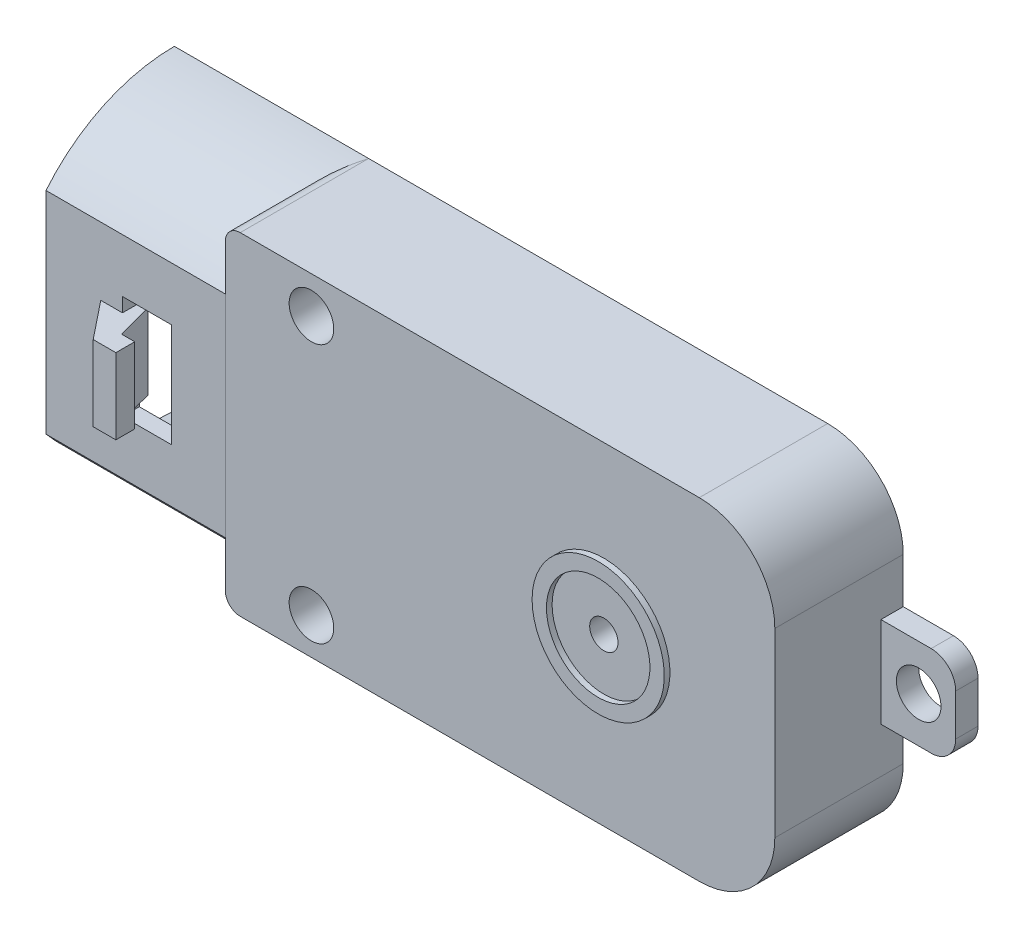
SolidWorks part; units mm, degrees
ref_plane "Front" through (0, 0, 0) normal (0, 0, 1) x (1, 0, 0)
ref_plane "Top" through (0, 0, 0) normal (0, 1, 0) x (1, 0, 0)
ref_plane "Right" through (0, 0, 0) normal (1, 0, 0) x (0, 0, -1)
sketch "Sketch1" plane through (0, 0, 0) normal (0, 0, 1) x (1, 0, 0)
  line L0 (11.5, 0) -> (-49.9329, 0) construction
  line L1 (11.5, 11.176) -> (-37.522, 11.176)
  line L2 (11.5, 11.176) -> (11.5, -11.176)
  line L3 (11.5, -11.176) -> (-37.522, -11.176)
  line L4 (-37.522, 11.176) -> (-37.522, -11.176)
  dimension "D1" = 49.022
  dimension "D2" = 22.352
  dimension "D3" = 11.5
extrude "Extrude1" add sketch "Sketch1" along normal blind 8.636
sketch "Sketch2" plane through (0, 0, 8.636) normal (0, 0, 1) x (1, 0, 0)
  line L0 (11.5, -11.176) -> (11.5, 11.176) construction
  line L1 (11.5, 11.176) -> (-37.522, 11.176) construction
  circle A0 centre (0, 0) radius 0.9525
  circle A3 centre (-19.6658, 8.7122) radius 1.5
  dimension "D1" = 1.905
  dimension "D2" = 2.4638
  dimension "D6" = 3
  dimension "D7" = 31.1658
extrude "Cut-Extrude1" cut sketch "Sketch2" against normal through all
ref_plane "Plane1" through (0, 0, 0) normal (0, 1, 0) x (-1, 0, 0)
mirror "Mirror1" about plane through (0, 0, 0) normal (0, 1, 0) of "Cut-Extrude1"
fillet "Fillet1" radius 5.08 2 edges at (11.5, -11.176, 4.318) (11.5, 11.176, 4.318)
sketch "Sketch3" plane through (0, 0, 8.636) normal (0, 0, 1) x (1, 0, 0)
  circle A0 centre (0, 0) radius 4.445
  circle A1 centre (0, 0) radius 3.4798
  dimension "D1" = 0.9652
  dimension "D2" = 8.89
extrude "Extrude2" add sketch "Sketch3" along normal blind 0.381
sketch "Sketch4" plane through (-37.522, 0, 0) normal (-1, 0, 0) x (0, 0, 1)
  line L0 (8.636, 11.176) -> (0, 11.176) construction
  line L3 (8.636, 11.176) -> (8.636, -11.176) construction
  line L5 (8.6335, 7.0969) -> (8.6335, 0)
  arc A0 (8.6335, 7.0969) -> (0, 11.176) centre (0, 0) ccw
  dimension "D1" = 0.0025
extrude "Cut-Extrude-Thin1" cut sketch "Sketch4" against normal blind 12.065 thin
mirror "Mirror5" about plane through (0, 0, 0) normal (0, 1, 0) of "Cut-Extrude-Thin1"
fillet "Fillet2" radius 1 2 edges at (-25.457, 11.176, 4.318) (-25.457, -11.176, 4.318)
sketch "Sketch8" plane through (0, 0, 8.6335) normal (0, 0, 1) x (1, 0, 0)
  line L0 (-37.522, -7.0969) -> (-37.522, 7.0969) construction
  line L1 (-29.0765, 3.4925) -> (-32.3785, 3.4925)
  line L2 (-29.0765, 3.4925) -> (-29.0765, -3.4925)
  line L3 (-29.0765, -3.4925) -> (-32.3785, -3.4925)
  line L4 (-32.3785, 3.4925) -> (-32.3785, -3.4925)
  line L5 (-37.522, -11.176) -> (-24.457, -11.176) construction
  dimension "D1" = 6.985
  dimension "D2" = 3.302
  dimension "D3" = 5.1435
  dimension "D4" = 7.6835
extrude "Cut-Extrude8" cut sketch "Sketch8" against normal blind 10
sketch "Sketch7" plane through (-37.522, 0, 0) normal (-1, 0, 0) x (0, 0, 1)
  line L0 (8.6335, -7.0969) -> (8.6335, 7.0969) construction
  line L1 (0, 11.176) -> (0, -11.176) construction
  line L2 (8.6335, -7.0969) -> (8.6335, 7.0969) construction
  line L3 (0, 11.176) -> (0, -11.176) construction
  line L4 (7.5035, -6.6798) -> (7.5035, 6.6798)
  line L5 (0, 10.046) -> (0, -10.046)
  arc A0 (0, -11.176) -> (8.6335, -7.0969) centre (0, 0) ccw construction
  arc A1 (8.6335, 7.0969) -> (0, 11.176) centre (0, 0) ccw construction
  arc A2 (0, -11.176) -> (8.6335, -7.0969) centre (0, 0) ccw construction
  arc A3 (8.6335, 7.0969) -> (0, 11.176) centre (0, 0) ccw construction
  arc A4 (7.5035, 6.6798) -> (0, 10.046) centre (0, 0) ccw
  arc A5 (0, -10.046) -> (7.5035, -6.6798) centre (0, 0) ccw
  dimension "D1" = 1.13
extrude "Cut-Extrude7" cut sketch "Sketch7" against normal blind 12
ref_plane "Plane2" through (0, 2.54, 0) normal (0, -1, 0) x (1, 0, 0)
sketch "Sketch9" plane through (0, 2.54, 0) normal (0, -1, 0) x (1, 0, 0)
  line L0 (-33.839, 8.6335) -> (-31.807, 11.1735)
  line L1 (-31.807, 11.1735) -> (-30.283, 11.1735)
  line L2 (-30.283, 11.1735) -> (-30.283, 9.9035)
  line L3 (-30.283, 9.9035) -> (-31.172, 9.9035)
  line L4 (-31.172, 9.9035) -> (-31.807, 7.5035)
  line L5 (-31.807, 7.5035) -> (-32.3785, 7.5035)
  line L6 (-25.457, 8.6335) -> (-37.522, 8.6335) construction
  line L8 (-32.3785, 7.5035) -> (-32.3785, 8.6335)
  line L9 (-32.3785, 8.6335) -> (-33.839, 8.6335)
  line L10 (-37.522, 8.6335) -> (-37.522, 0) construction
  dimension "D1" = 2.54
  dimension "D2" = 3.683
  dimension "D3" = 5.715
  dimension "D4" = 1.27
  dimension "D5" = 7.239
  dimension "D6" = 0.889
  dimension "D7" = 5.715
extrude "Extrude3" add sketch "Sketch9" along normal blind 5.08
sketch "Sketch10" plane through (0, 0, 0) normal (0, 0, -1) x (-1, 0, 0)
  line L0 (5.2027, 0) -> (-5.2027, 0) construction
  line L1 (0, 0) -> (-14.537, 0) construction
  line L3 (-11.5, -6.096) -> (-11.5, 6.096) construction
  line L5 (-11.5, 3.048) -> (-14.8782, 3.048)
  line L6 (-11.5, 3.048) -> (-11.5, -3.048)
  line L7 (-11.5, -3.048) -> (-14.8782, -3.048)
  line L8 (-16.5292, 1.397) -> (-16.5292, -1.397)
  circle A0 centre (-14.04, 0) radius 1.5
  arc A1 (-14.8782, -3.048) -> (-16.5292, -1.397) centre (-14.8782, -1.397) cw
  arc A2 (-14.8782, 3.048) -> (-16.5292, 1.397) centre (-14.8782, 1.397) ccw
  dimension "D1" = 3
  dimension "D2" = 2.54
  dimension "D3" = 5.0292
  dimension "D5" = 6.096
  dimension "D6" = 1.651
  dimension "D4" = 3.048
extrude "Extrude4" add sketch "Sketch10" against normal blind 1.5
sketch "Skica1" plane through (0, 0, 8.636) normal (0, 0, 1) x (1, 0, 0)
  point P0 (-19.6658, 8.7122)
  point P1 (-19.6658, -8.7122)
  point P3 (14.04, 0)
  dimension "D1" = 17.4244
  dimension "D2" = 33.7058
